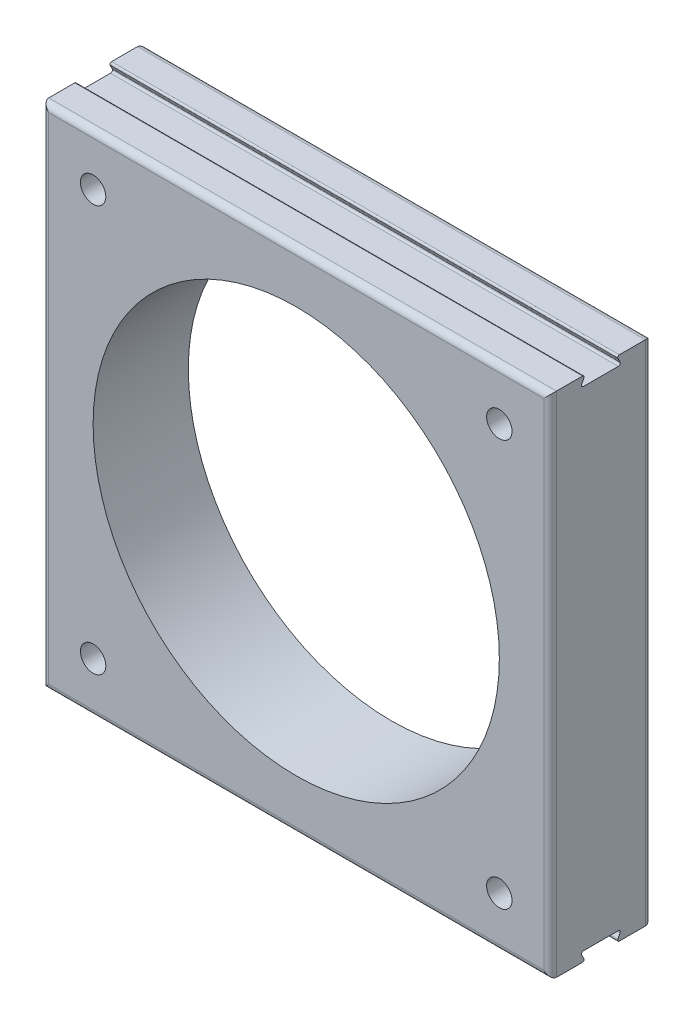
SolidWorks part; units mm, degrees
ref_plane "Plane1" through (0, 0, 0) normal (0, 0, 1) x (1, 0, 0)
ref_plane "Plane2" through (0, 0, 0) normal (0, 1, 0) x (1, 0, 0)
ref_plane "Plane3" through (0, 0, 0) normal (1, 0, 0) x (0, 0, -1)
sketch "Sketch1" plane through (0, 0, 0) normal (0, 0, 1) x (1, 0, 0)
  line L0 (-127, 127) -> (127, 127)
  line L1 (-127, 127) -> (-127, -127)
  line L2 (127, -127) -> (-127, -127)
  line L3 (127, -127) -> (127, 127)
  dimension "Length" = 254
  dimension "D2" = 127
  dimension "Width" = 254
  dimension "D4" = 127
extrude "Base-Extrude" add sketch "Sketch1" along normal mid plane 50.8
sketch "Sketch2" plane through (127, 0, 0) normal (1, 0, 0) x (0, 0, -1)
  line L0 (-7.9375, 127) -> (7.9375, 127)
  line L1 (8.7312, 122.2375) -> (-8.7312, 122.2375)
  line L4 (-25.4, 127) -> (25.4, 127) construction
  line L5 (0, 127) -> (0, 111.4524) construction
  line L6 (7.9375, 127) -> (9.5904, 123.6127)
  line L7 (-7.9375, 127) -> (-9.5904, 123.6127)
  arc A0 (9.5904, 123.6127) -> (8.7312, 122.2375) centre (8.7312, 123.1935) cw
  arc A1 (-9.5904, 123.6127) -> (-8.7312, 122.2375) centre (-8.7312, 123.1935) ccw
  point P6 (0, 127)
  dimension "D1" = 15.875
  dimension "D2" = 4.7625
  dimension "D3" = 17.4625
sketch "Sketch3" plane through (0, 0, 0) normal (0, 0, 1) x (1, 0, 0)
  line L4 (-127, 127) -> (-127, -127)
  line L5 (-127, -127) -> (127, -127)
  line L6 (127, -127) -> (127, 127)
  line L7 (127, 127) -> (-127, 127)
  line L11 (127, 127) -> (-127, 127)
  dimension "D1" = 0
sweep "Cut-Sweep1" cut profiles "Sketch2" path "Sketch3"
fillet "Fillet4" radius 0.7937 2 edges at (0, 127, 7.9375) (0, 127, -7.9375)
mirror "Mirror3" about plane through (0, 0, 0) normal (0, 1, 0) of "Fillet4", "Cut-Sweep1"
fillet "Fillet2" radius 3.175 8 edges at (127, 0, 25.4) (0, 127, 25.4) (-127, 0, 25.4) (0, 127, -25.4) (127, 0, -25.4) (0, -127, -25.4) (-127, 0, -25.4) (0, -127, 25.4)
sketch "Sketch4" plane through (0, 0, 25.4) normal (0, 0, 1) x (1, 0, 0)
  line L0 (-127, 127) -> (127, 127) construction
  line L1 (-127, -127) -> (-127, 127) construction
  circle A0 centre (-101.6, 101.6) radius 6.35
  dimension "D1" = 25.4
  dimension "D3" = 12.7
  dimension "D2" = 25.4
extrude "Cut-Extrude1" cut sketch "Sketch4" against normal through all
mirror "Mirror1" about plane through (0, 0, 0) normal (0, 1, 0) of "Cut-Extrude1"
mirror "Mirror2" about plane through (0, 0, 0) normal (1, 0, 0) of "Cut-Extrude1", "Mirror1"
sketch "Sketch5" plane through (0, 0, -25.4) normal (0, 0, -1) x (-1, 0, 0)
  circle A0 centre (0, 0) radius 107.95
  circle A1 centre (0, 0) radius 101.6
  dimension "D1" = 215.9
  dimension "Diameter" = 203.2
extrude "Cut-Extrude2" cut sketch "Sketch5" against normal blind 3.175
sketch "Sketch7" plane through (0, 0, -25.4) normal (0, 0, -1) x (-1, 0, 0)
  circle A1 centre (0, 0) radius 101.6
  circle A2 centre (0, 0) radius 101.6
  dimension "D1" = 0
extrude "Cut-Extrude3" cut sketch "Sketch7" against normal through all
equation "\"D2@Sketch1\" = \"Length@Sketch1\"/2"
equation "\"D4@Sketch1\" = \"Width@Sketch1\"/2"
equation "\"D1@Sketch5\" = \"Diameter@Sketch5\"+.5"
